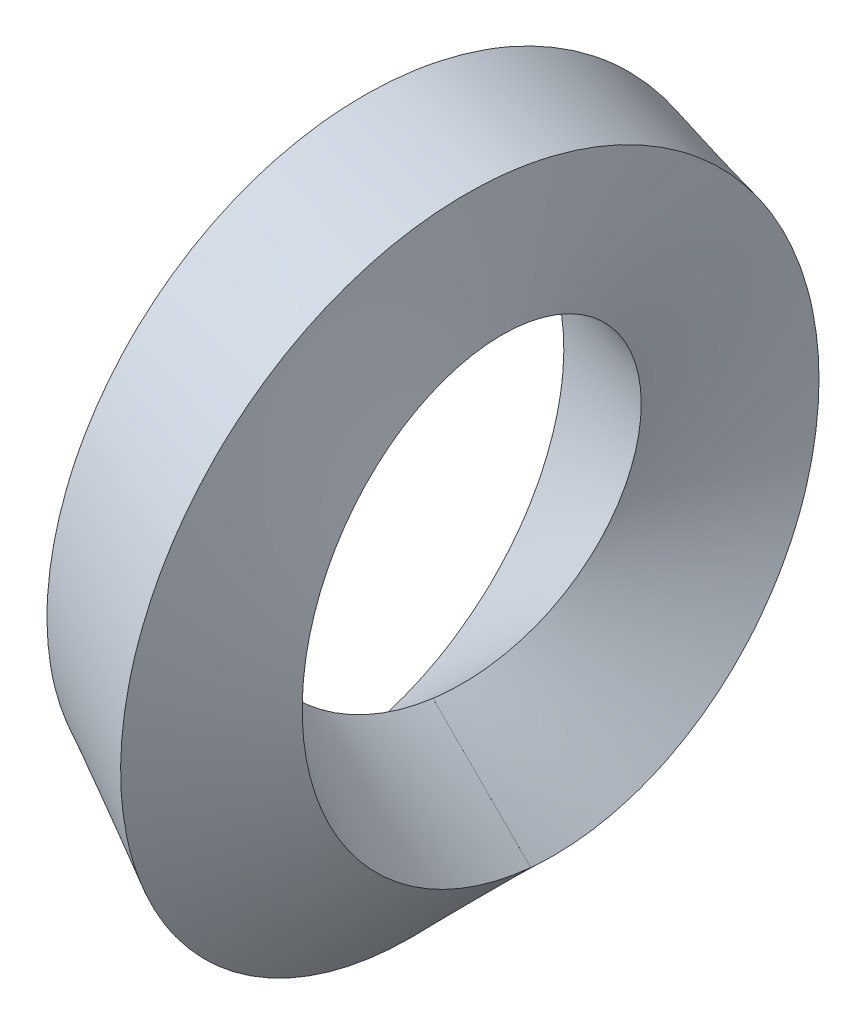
SolidWorks part; units mm, degrees
ref_plane "Plane1" through (0, 0, 0) normal (0, 0, 1) x (1, 0, 0)
ref_plane "Plane2" through (0, 0, 0) normal (0, 1, 0) x (1, 0, 0)
ref_plane "Plane3" through (0, 0, 0) normal (1, 0, 0) x (0, 0, -1)
sketch "Sketch1" plane through (0, 0, 0) normal (0, 0, 1) x (1, 0, 0)
  line L0 (0, -12.782) -> (0, 12.782) construction
  line L1 (-12.782, 12.782) -> (12.782, 12.782)
  line L2 (-12.782, 12.782) -> (-12.782, -12.782)
  line L3 (-12.782, -12.782) -> (12.782, -12.782)
  line L4 (12.782, 12.782) -> (12.782, -12.782)
extrude "Extrude1" add sketch "Sketch1" along normal mid plane 300
other "Flex1" parameters "D0"=90, "D1"=0, "D2"=0
other "Flex2" parameters "D0"=360, "D1"=0, "D2"=0
